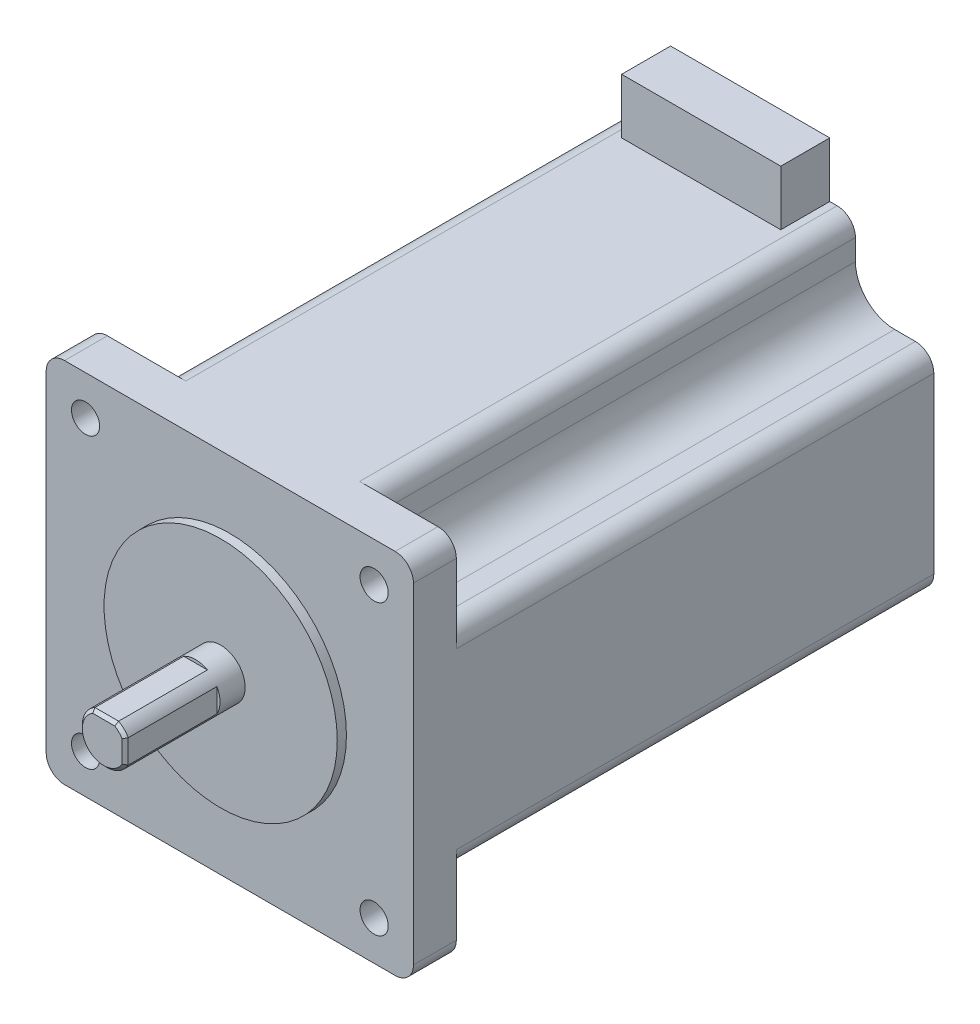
SolidWorks part; units mm, degrees
ref_plane "前视基准面" through (0, 0, 0) normal (0, 0, 1) x (1, 0, 0)
ref_plane "上视基准面" through (0, 0, 0) normal (0, 1, 0) x (1, 0, 0)
ref_plane "右视基准面" through (0, 0, 0) normal (1, 0, 0) x (0, 0, -1)
sketch "草图1" plane through (0, 0, 0) normal (0, 0, 1) x (1, 0, 0)
  circle A0 centre (0, 0) radius 19.05
extrude "凸台-拉伸1" add sketch "草图1" against normal blind 1.5
sketch "草图2" plane through (0, 0, 0) normal (0, 0, 1) x (1, 0, 0)
  circle A0 centre (0, 0) radius 4
extrude "凸台-拉伸2" add sketch "草图2" along normal blind 19.1
sketch "草图3" plane through (0, 0, 19.1) normal (0, 0, 1) x (1, 0, 0)
  line L0 (3.5, 0) -> (3.5, -4)
  line L1 (0, 3.5) -> (3, 3.5)
  line L2 (3, 3.5) -> (3, 6.1575)
  line L3 (3, 6.1575) -> (-4, 6.1575)
  line L4 (-4, 6.1575) -> (-4, 3.5)
  line L5 (-4, 3.5) -> (0, 3.5)
  line L7 (3.5, -4) -> (7.6659, -4)
  line L8 (7.6659, -4) -> (7.6659, 3.5)
  line L9 (7.6659, 3.5) -> (3.5, 3.5)
  line L10 (3.5, 3.5) -> (3.5, 0)
extrude "切除-拉伸1" cut sketch "草图3" against normal blind 15
chamfer "倒角1" distance 0.5 angle 45 4 edges at (0, 3.5, 19.1) (2.8284, 2.8284, 19.1) (-2.8284, -2.8284, 19.1) (3.5, 0, 19.1)
sketch "草图4" plane through (0, 0, -1.5) normal (0, 0, -1) x (-1, 0, 0)
  line L1 (0, 30) -> (27, 30)
  line L2 (30, 27) -> (30, -27)
  line L3 (27, -30) -> (-27, -30)
  line L4 (-30, -27) -> (-30, 27)
  line L5 (-27, 30) -> (0, 30)
  arc A0 (-27, -30) -> (-30, -27) centre (-27, -27) cw
  arc A1 (30, -27) -> (27, -30) centre (27, -27) cw
  arc A2 (27, 30) -> (30, 27) centre (27, 27) cw
  arc A3 (-30, 27) -> (-27, 30) centre (-27, 27) cw
  circle A4 centre (23.57, 23.57) radius 2.3
  circle A5 centre (23.57, -23.57) radius 2.3
  circle A6 centre (-23.57, -23.57) radius 2.3
  circle A7 centre (-23.57, 23.57) radius 2.3
  dimension "D1" = 3
extrude "凸台-拉伸3" add sketch "草图4" along normal blind 85
sketch "草图5" plane through (0, 0, -86.5) normal (0, 0, -1) x (-1, 0, 0)
  line L1 (27, 30) -> (-27, 30) construction
  line L2 (10.2835, 30) -> (14.2, 30)
  line L3 (17.2, 27) -> (17.2, 23.6)
  line L4 (23.6, 17.2) -> (27, 17.2)
  line L5 (-10.2835, 39.1307) -> (-10.2835, 30)
  line L6 (30, -27) -> (30, 27) construction
  line L7 (30, 14.2) -> (30, 9.8667)
  line L8 (30, 9.8667) -> (35.4123, 9.8667)
  line L9 (35.4123, 9.8667) -> (35.4123, 39.1307)
  line L10 (35.4123, 39.1307) -> (10.2835, 39.1307)
  line L11 (10.2835, 39.1307) -> (10.2835, 30)
  line L13 (-35.4123, 39.1307) -> (-10.2835, 39.1307)
  line L14 (-35.4123, 9.8667) -> (-35.4123, 39.1307)
  line L15 (-30, 9.8667) -> (-35.4123, 9.8667)
  line L16 (-30, 14.2) -> (-30, 9.8667)
  line L17 (-23.6, 17.2) -> (-27, 17.2)
  line L18 (-17.2, 27) -> (-17.2, 23.6)
  line L19 (-10.2835, 30) -> (-14.2, 30)
  line L20 (10.2835, -39.1307) -> (10.2835, -30)
  line L21 (35.4123, -39.1307) -> (10.2835, -39.1307)
  line L22 (35.4123, -9.8667) -> (35.4123, -39.1307)
  line L23 (30, -9.8667) -> (35.4123, -9.8667)
  line L24 (30, -14.2) -> (30, -9.8667)
  line L25 (23.6, -17.2) -> (27, -17.2)
  line L26 (17.2, -27) -> (17.2, -23.6)
  line L27 (10.2835, -30) -> (14.2, -30)
  line L28 (-10.2835, -30) -> (-14.2, -30)
  line L29 (-17.2, -27) -> (-17.2, -23.6)
  line L30 (-23.6, -17.2) -> (-27, -17.2)
  line L31 (-30, -14.2) -> (-30, -9.8667)
  line L32 (-30, -9.8667) -> (-35.4123, -9.8667)
  line L33 (-35.4123, -9.8667) -> (-35.4123, -39.1307)
  line L34 (-35.4123, -39.1307) -> (-10.2835, -39.1307)
  line L35 (-10.2835, -39.1307) -> (-10.2835, -30)
  arc A0 (17.2, 23.6) -> (23.6, 17.2) centre (23.6, 23.6) ccw
  arc A1 (27, 17.2) -> (30, 14.2) centre (27, 14.2) cw
  arc A2 (14.2, 30) -> (17.2, 27) centre (14.2, 27) cw
  arc A3 (-14.2, 30) -> (-17.2, 27) centre (-14.2, 27) ccw
  arc A4 (-27, 17.2) -> (-30, 14.2) centre (-27, 14.2) ccw
  arc A5 (-17.2, 23.6) -> (-23.6, 17.2) centre (-23.6, 23.6) cw
  arc A6 (14.2, -30) -> (17.2, -27) centre (14.2, -27) ccw
  arc A7 (27, -17.2) -> (30, -14.2) centre (27, -14.2) ccw
  arc A8 (17.2, -23.6) -> (23.6, -17.2) centre (23.6, -23.6) cw
  arc A9 (-17.2, -23.6) -> (-23.6, -17.2) centre (-23.6, -23.6) ccw
  arc A10 (-27, -17.2) -> (-30, -14.2) centre (-27, -14.2) cw
  arc A11 (-14.2, -30) -> (-17.2, -27) centre (-14.2, -27) cw
  point P20 (30, 17.2)
  point P23 (17.2, 30)
  point P38 (-17.2, 30)
  point P39 (-30, 17.2)
  point P54 (17.2, -30)
  point P55 (30, -17.2)
  point P70 (-30, -17.2)
  point P71 (-17.2, -30)
  dimension "D1" = 6.4
  dimension "D2" = 3
extrude "切除-拉伸2" cut sketch "草图5" against normal blind 78
sketch "草图6" plane through (0, 0, -86.5) normal (0, 0, -1) x (-1, 0, 0)
  line L0 (0, 30) -> (13, 30)
  line L1 (14.2, 30) -> (-14.2, 30) construction
  line L2 (13, 30) -> (13, 39)
  line L3 (13, 39) -> (-13, 39)
  line L4 (-13, 39) -> (-13, 30)
  line L5 (-13, 30) -> (0, 30)
extrude "凸台-拉伸4" add sketch "草图6" against normal blind 8 separate body
